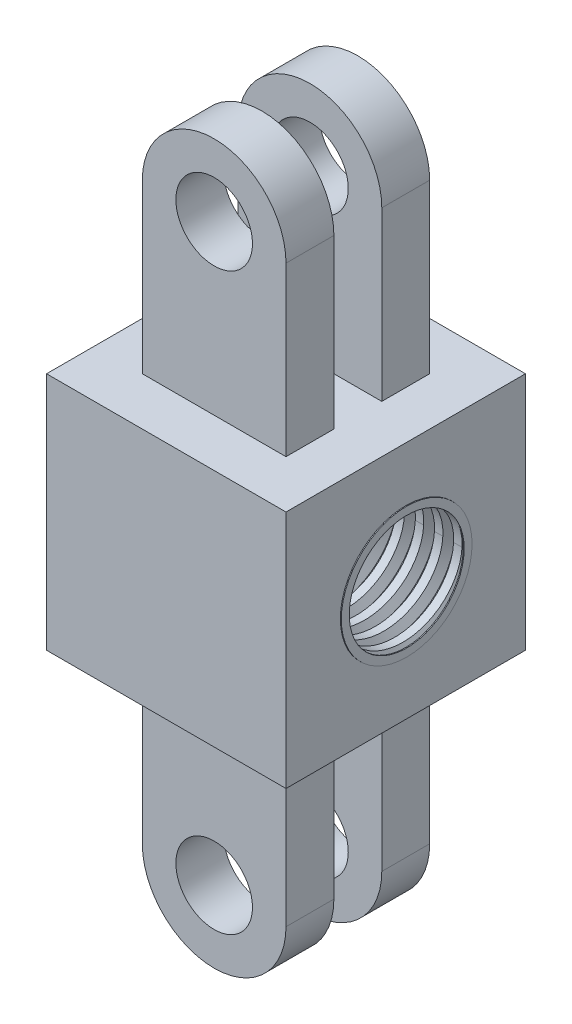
SolidWorks part; units mm, degrees
ref_plane "Front Plane" through (0, 0, 0) normal (0, 0, 1) x (1, 0, 0)
ref_plane "Top Plane" through (0, 0, 0) normal (0, 1, 0) x (1, 0, 0)
ref_plane "Right Plane" through (0, 0, 0) normal (1, 0, 0) x (0, 0, -1)
sketch "Sketch1" plane through (0, 0, 0) normal (0, 1, 0) x (1, 0, 0)
  line L1 (0, 0) -> (25, 0)
  line L2 (0, 0) -> (0, -25)
  line L3 (0, -25) -> (25, -25)
  line L4 (25, 0) -> (25, -25)
  dimension "D1" = 25
  dimension "D2" = 25
extrude "Boss-Extrude1" add sketch "Sketch1" along normal blind 25
sketch "Sketch2" plane through (0, 25, 0) normal (0, 1, 0) x (1, 0, 0)
  line L0 (0, -12.5) -> (48.3049, -12.5) construction
  line L1 (0, 0) -> (0, -25) construction
  line L2 (25, 0) -> (0, 0) construction
  line L3 (5, -5) -> (20, -5)
  line L4 (5, -5) -> (5, -10)
  line L5 (5, -10) -> (20, -10)
  line L6 (20, -5) -> (20, -10)
  line L9 (20, -20) -> (20, -15)
  line L10 (5, -15) -> (20, -15)
  line L11 (5, -20) -> (5, -15)
  line L12 (5, -20) -> (20, -20)
  dimension "D1" = 5
  dimension "D2" = 5
  dimension "D3" = 5
  dimension "D4" = 15
extrude "Boss-Extrude2" add sketch "Sketch2" along normal blind 17.5
sketch "Sketch3" plane through (0, 0, 20) normal (0, 0, 1) x (1, 0, 0)
  line L0 (5, 42.5) -> (20, 42.5) construction
  circle A0 centre (12.5, 42.5) radius 7.5
  circle A1 centre (12.5, 42.5) radius 4
  dimension "D1" = 8
extrude "Boss-Extrude4" add sketch "Sketch3" against normal up to surface (5 mm away)
sketch "Sketch4" plane through (0, 0, 20) normal (0, 0, 1) x (1, 0, 0)
  line L0 (8.5, 42.5) -> (16.5, 42.5) construction
  circle A0 centre (12.5, 42.5) radius 4
extrude "Cut-Extrude1" cut sketch "Sketch4" against normal blind 21.5
sketch "Sketch5" plane through (0, 0, 5) normal (0, 0, -1) x (-1, 0, 0)
  line L0 (-8.5, 42.5) -> (-5, 42.5) construction
  line L1 (-20, 42.5) -> (-16.5, 42.5) construction
  line L2 (-8.5, 42.5) -> (-5, 42.5)
  line L3 (-20, 42.5) -> (-16.5, 42.5)
  circle A0 centre (-12.5, 42.5) radius 4 construction
  arc A1 (-5, 42.5) -> (-20, 42.5) centre (-12.5, 42.5) ccw construction
  circle A2 centre (-12.5, 42.5) radius 4
  arc A3 (-5, 42.5) -> (-20, 42.5) centre (-12.5, 42.5) ccw
extrude "Boss-Extrude5" add sketch "Sketch5" against normal up to surface (5 mm away) contours A3 A2 M1 M3
ref_plane "Plane1" through (0, 12.5, 0) normal (0, 1, 0) x (1, 0, 0)
mirror "Mirror1" about plane through (0, 12.5, 0) normal (0, 1, 0) of "Boss-Extrude5", "Cut-Extrude1", "Boss-Extrude4", "Boss-Extrude2", "Boss-Extrude1"
sketch "Sketch6" plane through (25, 0, 0) normal (1, 0, 0) x (0, 0, -1)
  line L0 (-25, 0) -> (0, 0) construction
  line L1 (0, 25) -> (0, 0) construction
  circle A0 centre (-12.5, 12.5) radius 6
  dimension "D3" = 12
  dimension "D1" = 12.5
  dimension "D2" = 12.5
extrude "Cut-Extrude2" cut sketch "Sketch6" against normal blind 63.5
thread "Thread2" pitch 1.5 start angle 0, offset 2, length 30, pitch 2, diameter 12
ref_plane "Plane4" through (27, 12.5, 18.5) normal (0, -1, 0) x (0, 0, 1)
sketch "Thread Profile3" plane through (27, 12.5, 18.5) normal (0, -1, 0) x (0, 0, 1)
  line L0 (0, 0) -> (0, 1.5) construction
  line L1 (0, 0) -> (0.8119, 0.4687)
  line L2 (0.8119, 0.4687) -> (0.8119, 0.6562)
  line L3 (0.8119, 0.6562) -> (0, 1.125)
  line L4 (0.8119, 0.5625) -> (0, 0.5625) construction
  line L11 (0, 0) -> (0, 1.125)
  point P2 (0, 0)
  dimension "Pitch" = 1.5
  dimension "Profile_Angle" = 60
  dimension "Profile_Land" = 0.1875
  dimension "Profile_Height" = 0.8119
sketch "Sketch7" plane through (25, 0, 0) normal (1, 0, 0) x (0, 0, -1)
  circle A0 centre (-12.5, 12.5) radius 6
  circle A1 centre (-12.5, 12.5) radius 6.8257
extrude "Boss-Extrude6" add sketch "Sketch7" along normal blind 0.1
